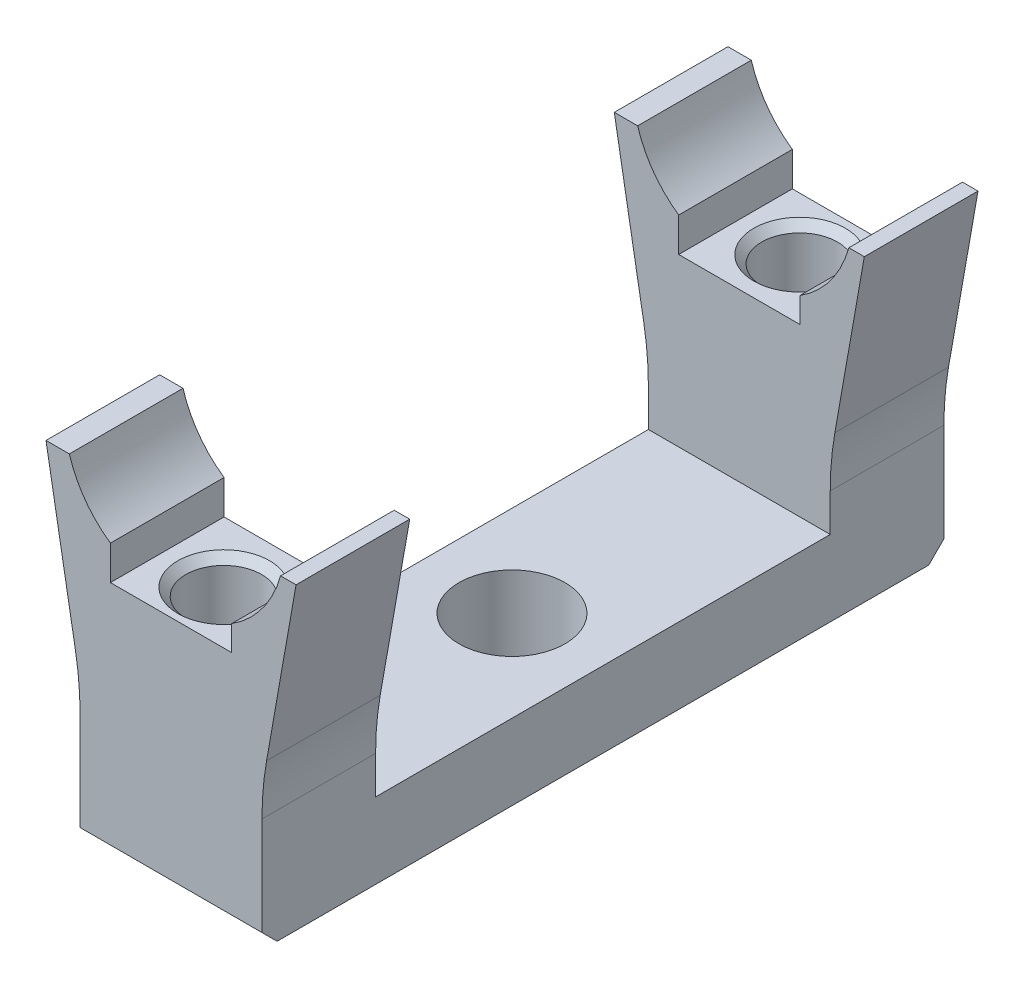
SolidWorks part; units mm, degrees
ref_plane "前视基准面" through (0, 0, 0) normal (0, 0, 1) x (1, 0, 0)
ref_plane "上视基准面" through (0, 0, 0) normal (0, 1, 0) x (1, 0, 0)
ref_plane "右视基准面" through (0, 0, 0) normal (1, 0, 0) x (0, 0, -1)
sketch "草图1" plane through (0, 0, 0) normal (0, 0, 1) x (1, 0, 0)
  line L0 (0, 1046.1853) -> (0, 31) construction
  line L1 (-6, 0) -> (6, 0)
  line L2 (6, 0) -> (6, 7.4898)
  line L3 (6.3038, 10.9628) -> (8.25, 22)
  line L4 (8.25, 22) -> (7.2284, 22)
  line L5 (8.25, 22) -> (8.25, 8.6821) construction
  line L6 (-6, 0) -> (-6, 7.4898)
  line L7 (-6.3038, 10.9628) -> (-8.25, 22)
  line L8 (-8.25, 22) -> (-6.7082, 22)
  line L9 (0, 22) -> (0, 0) construction
  line L10 (0, 22) -> (8.25, 22)
  line L11 (-4, 16) -> (4, 16)
  line L12 (-4, 16) -> (-4, 18.2554)
  line L13 (4, 16) -> (4, 17.6557)
  line L14 (-6, 5) -> (6, 5)
  arc A0 (4, 17.6557) -> (7.2284, 22) centre (0, 24) ccw
  arc A1 (-6.7082, 22) -> (-4, 18.2554) centre (0, 24) ccw
  arc A4 (6, 7.4898) -> (6.3038, 10.9628) centre (26, 7.4898) cw
  arc A5 (-6, 7.4898) -> (-6.3038, 10.9628) centre (-26, 7.4898) ccw
  point P10 (0, 0)
  point P22 (0, 16)
  point P23 (6, 9.2396)
  point P26 (-6, 9.2396)
  dimension "D1" = 15
  dimension "D7" = 14
  dimension "D10" = 20
  dimension "D2" = 6
  dimension "D3" = 24
  dimension "D4" = 22
  dimension "D5" = 10
  dimension "D6" = 8.25
  dimension "D8" = 4
  dimension "D9" = 6
  dimension "D11" = 5
extrude "凸台-拉伸3" add sketch "草图1" along normal blind 45 contours L14 L6 L1 L2 | A5 L6 L14 L2 A4 L3 L4 A0 L13 L11 L12 A1 L8 L7
sketch "草图4" plane through (0, 0, 0) normal (1, 0, 0) x (0, 0, -1)
  line L0 (-22.5, 25.6982) -> (-22.5, 5) construction
  line L1 (-37.5, 25.6982) -> (-7.5, 25.6982)
  line L2 (-37.5, 25.6982) -> (-37.5, 5)
  line L3 (-37.5, 5) -> (-7.5, 5)
  line L4 (-7.5, 25.6982) -> (-7.5, 5)
  line L5 (-45, 10.9628) -> (-45, 7.4898) construction
  line L7 (-45, 0) -> (-45, 7.4898) construction
  line L8 (-45, 0) -> (0, 0) construction
  dimension "D1" = 22.5
  dimension "D2" = 7.5
  dimension "D3" = 5
extrude "切除-拉伸1" cut sketch "草图4" against normal mid plane 45
sketch "草图5" plane through (0, 5, 0) normal (0, 1, 0) x (1, 0, 0)
  line L0 (6, -22.5) -> (-6, -22.5) construction
  line L1 (6, -7.5) -> (6, -37.5) construction
  line L2 (-6, -7.5) -> (-6, -37.5) construction
  circle A0 centre (0, -22.5) radius 3.5
  dimension "D1" = 7
extrude "切除-拉伸2" cut sketch "草图5" against normal mid plane 45
sketch "草图10" plane through (0, 16, 0) normal (0, 1, 0) x (1, 0, 0)
  point P0 (0, -41.5211)
  point P3 (0, -3.5211)
  dimension "D1" = 38
hole_wizard "M6 螺纹孔1" positions "草图10" profile "草图9" tap size "M6" standard "GB"
sketch "草图9" plane through (0, 16, 41.5211) normal (1, 0, 0) x (0, 0, 1)
  line L0 (0, 0) -> (0, 13.5022)
  line L1 (0, 13.5022) -> (2.5, 12)
  line L2 (2.5, 12) -> (2.5, 0.525)
  line L3 (2.5, 0.525) -> (3.025, 0)
  line L5 (3.025, 0) -> (0, 0)
  line L6 (-2.5, 0.525) -> (-3.025, 0) construction
  line L10 (0, 13.5022) -> (-2.5, 12) construction
  line L11 (0, -6.35) -> (0, 107.95) construction
  dimension "螺纹孔钻头直径" = 5
  dimension "螺纹孔钻头深度" = 12
  dimension "近端锥形沉头孔直径" = 6.05
  dimension "近端锥形沉头孔角度" = 90
  dimension "导头角度" = 118
chamfer "倒角2" distance 1 angle 45 2 edges at (0, 0, 0) (0, 0, 45)
